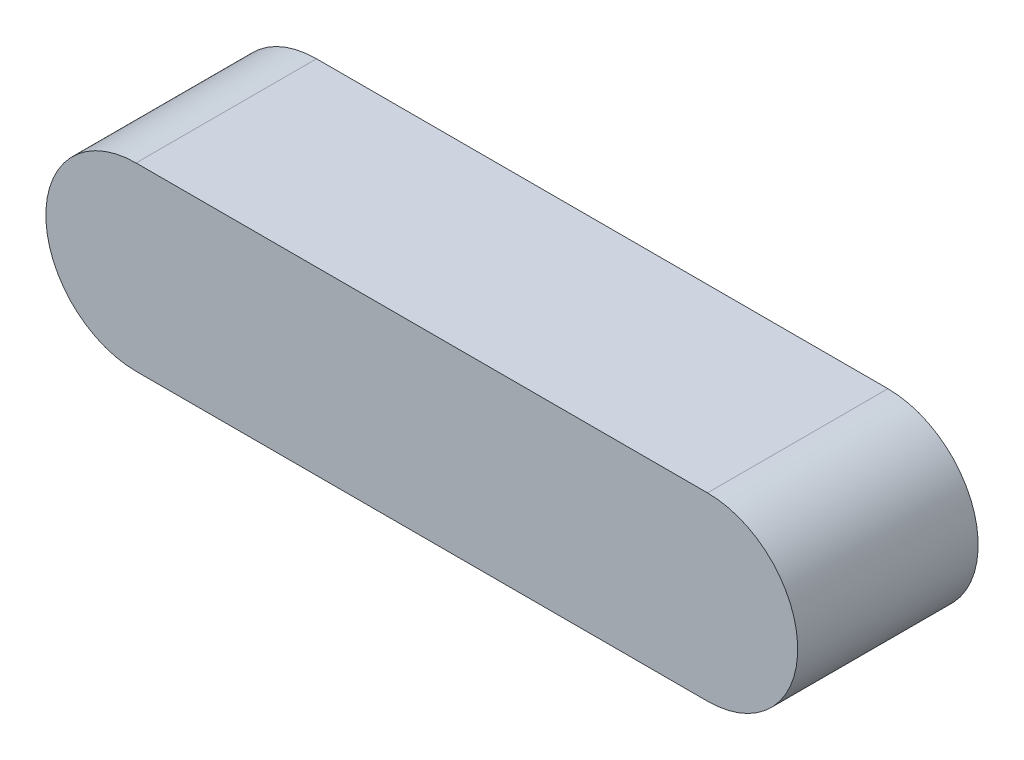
SolidWorks part; units mm, degrees
ref_plane "前视基准面" through (0, 0, 0) normal (0, 0, 1) x (1, 0, 0)
ref_plane "上视基准面" through (0, 0, 0) normal (0, 1, 0) x (1, 0, 0)
ref_plane "右视基准面" through (0, 0, 0) normal (1, 0, 0) x (0, 0, -1)
sketch "草图1" plane through (0, 0, 0) normal (0, 0, 1) x (1, 0, 0)
  line L0 (70, 3) -> (89, 3) construction
  line L1 (89, -3) -> (70, -3) construction
  line L2 (70, 3) -> (89, 3)
  line L3 (89, -3) -> (70, -3)
  arc A0 (70, 3) -> (70, -3) centre (70, 0) ccw construction
  arc A1 (89, -3) -> (89, 3) centre (89, 0) ccw construction
  arc A2 (70, 3) -> (70, -3) centre (70, 0) ccw
  arc A3 (89, -3) -> (89, 3) centre (89, 0) ccw
extrude "拉伸1" add sketch "草图1" along normal blind 6
